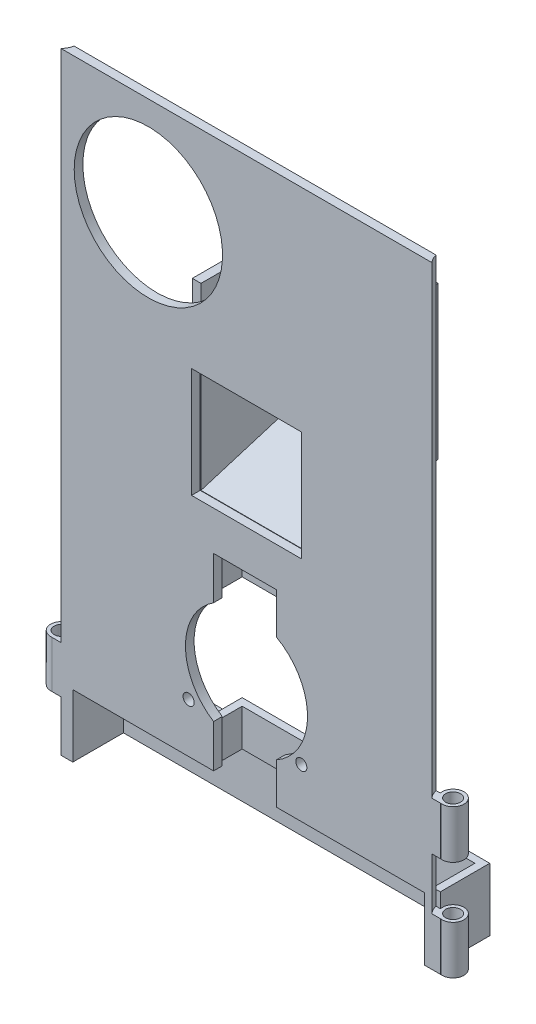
SolidWorks part; units mm, degrees
ref_plane "Front Plane" through (0, 0, 0) normal (0, 0, 1) x (1, 0, 0)
ref_plane "Top Plane" through (0, 0, 0) normal (0, 1, 0) x (1, 0, 0)
ref_plane "Right Plane" through (0, 0, 0) normal (1, 0, 0) x (0, 0, -1)
sketch "Sketch1" plane through (0, 0, 0) normal (0, 0, 1) x (1, 0, 0)
  line L1 (0, 0) -> (62.865, 0)
  line L2 (0, 0) -> (0, 99.06)
  line L3 (0, 99.06) -> (62.865, 99.06)
  line L4 (62.865, 0) -> (62.865, 99.06)
  dimension "D1" = 99.06
  dimension "D2" = 62.865
extrude "Boss-Extrude1" add sketch "Sketch1" along normal blind 1.4
sketch "Sketch2" plane through (0, 0, 0) normal (0, 1, 0) x (1, 0, 0)
  line L0 (31.4325, -1.4) -> (31.4325, 2.6427) construction
  line L1 (62.865, -1.4) -> (0, -1.4) construction
  line L2 (0, -1.4) -> (0, 0) construction
  circle A0 centre (-0.25, 0.35) radius 1.75
  circle A1 centre (63.115, 0.35) radius 1.75
  point P8 (0, -0.7)
  dimension "D1" = 0.25
extrude "Boss-Extrude2" add sketch "Sketch2" along normal up to surface (99.06 mm away)
ref_plane "Plane1" through (0, 12, 0) normal (0, 1, 0) x (1, 0, 0)
sketch "Sketch7" plane through (0, 12, 0) normal (0, 1, 0) x (1, 0, 0)
  line L0 (31.4325, -1.4) -> (31.4325, 1.55) construction
  line L1 (62.865, -1.4) -> (0, -1.4) construction
  circle A1 centre (-0.25, 0.35) radius 1.2
  circle A2 centre (63.115, 0.35) radius 1.2
extrude "Tube Hole" cut sketch "Sketch7" against normal through all both and the other way through all
sketch "Sketch8" plane through (0, 0, 0) normal (0, 0, -1) x (-1, 0, 0)
  line L0 (-31.4325, 99.06) -> (-31.4325, 40.64) construction
  line L1 (-61.4004, 99.06) -> (-1.4646, 99.06) construction
  line L2 (-1.4646, 0) -> (-61.4004, 0) construction
  line L3 (-36.2672, 16.7864) -> (-36.2672, 10.16)
  line L4 (-40.3225, 64.77) -> (-22.5425, 64.77)
  line L5 (-40.3225, 64.77) -> (-40.3225, 46.99)
  line L6 (-40.3225, 46.99) -> (-22.5425, 46.99)
  line L7 (-22.5425, 64.77) -> (-22.5425, 46.99)
  line L8 (-40.3225, 64.77) -> (-22.5425, 46.99) construction
  line L9 (-40.3225, 46.99) -> (-22.5425, 64.77) construction
  line L10 (-36.2672, 40.64) -> (-26.1072, 40.64)
  line L11 (-36.2672, 40.64) -> (-36.2672, 34.0136)
  line L12 (-36.2672, 10.16) -> (-26.1072, 10.16)
  line L13 (-26.1072, 40.64) -> (-26.1072, 33.7192)
  line L14 (-26.1072, 17.0808) -> (-26.1072, 10.16)
  line L17 (-31.4325, 10.16) -> (-31.4325, 0) construction
  circle A0 centre (-15.5525, 83.18) radius 12
  arc A1 (-36.2672, 34.0136) -> (-36.2672, 16.7864) centre (-31.4325, 25.4) ccw
  arc A3 (-26.1072, 17.0808) -> (-26.1072, 33.7192) centre (-31.4325, 25.4) ccw
  point P8 (-31.4325, 55.88)
  point P15 (-31.4325, 25.4)
  point P22 (-15.6947, 83.18)
  dimension "D6" = 25.4
  dimension "D7" = 10.16
  dimension "D1" = 15.88
  dimension "D2" = 15.88
  dimension "D3" = 17.78
  dimension "D4" = 17.78
  dimension "D5" = 46.99
  dimension "D8" = 30.48
  dimension "D9" = 10.16
extrude "Panel Holes" cut sketch "Sketch8" against normal blind 4.2
sketch "Sketch9" plane through (0, 12, 0) normal (0, 1, 0) x (1, 0, 0)
  circle A0 centre (63.115, 0.35) radius 2.4
extrude "Cut-Extrude1" cut sketch "Sketch9" against normal blind 4.2 and the other way blind 4.2
sketch "Sketch10" plane through (0, 12, 0) normal (0, 1, 0) x (1, 0, 0)
  circle A0 centre (63.115, 0.35) radius 2.4
extrude "Cut-Extrude2" cut sketch "Sketch10" along normal up to surface (75.06 mm away) from offset 12
sketch "Sketch11" plane through (0, 12, 0) normal (0, 1, 0) x (1, 0, 0)
  circle A0 centre (-0.25, 0.35) radius 2.4
extrude "Cut-Extrude3" cut sketch "Sketch11" against normal up to surface (8.2 mm away) from offset 3.8
sketch "Sketch12" plane through (0, 12, 0) normal (0, 1, 0) x (1, 0, 0)
  circle A0 centre (-0.25, 0.35) radius 2.4
extrude "Cut-Extrude4" cut sketch "Sketch12" along normal up to surface (83.26 mm away) from offset 3.8
sketch "Sketch13" plane through (0, 0, 0) normal (0, 0, -1) x (-1, 0, 0)
  line L0 (-31.4325, 99.06) -> (-31.7623, 0) construction
  line L1 (-60.7407, 99.06) -> (-2.1243, 99.06) construction
  line L2 (-2.1243, 0) -> (-61.4004, 0) construction
  line L3 (-40.3225, 46.99) -> (-22.5425, 46.99) construction
  line L4 (-41.8498, 76.07) -> (-21.2698, 76.07)
  line L5 (-41.8498, 76.07) -> (-41.8498, 45.59)
  line L6 (-41.8498, 45.59) -> (-21.2698, 45.59)
  line L7 (-21.2698, 76.07) -> (-21.2698, 45.59)
  line L8 (-41.8498, 76.07) -> (-21.2698, 45.59) construction
  line L9 (-41.8498, 45.59) -> (-21.2698, 76.07) construction
  point P6 (-31.5598, 60.83)
  dimension "D1" = 1.4
  dimension "D2" = 20.58
  dimension "D3" = 30.48
extrude "Boss-Extrude3" add sketch "Sketch13" along normal blind 19.18
sketch "Sketch14" plane through (0, 76.07, 0) normal (0, 1, 0) x (1, 0, 0)
  line L0 (60.7407, 0) -> (2.1243, 0) construction
  line L1 (22.6698, 0) -> (40.4498, 0)
  line L2 (22.6698, 0) -> (22.6698, 17.78)
  line L3 (22.6698, 17.78) -> (40.4498, 17.78)
  line L4 (40.4498, 0) -> (40.4498, 17.78)
  line L5 (21.2698, 19.18) -> (21.2698, 0) construction
  line L6 (41.8498, 19.18) -> (41.8498, 0) construction
  line L7 (21.2698, 19.18) -> (41.8498, 19.18) construction
  dimension "D1" = 1.4
  dimension "D2" = 1.4
  dimension "D3" = 1.4
sketch "Sketch15" plane through (21.2698, 0, 0) normal (-1, 0, 0) x (0, 0, 1)
  line L0 (-19.18, 45.59) -> (-19.18, 76.07) construction
  line L1 (-19.18, 51.432) -> (0, 45.59)
  line L2 (0, 45.59) -> (-19.18, 45.59)
  line L3 (-19.18, 45.59) -> (-19.18, 51.432)
  point P0 (-19.18, 51.432)
  dimension "D1" = 5.842
extrude "Cut-Extrude5" cut sketch "Sketch15" against normal through all
extrude "Cut-Extrude6" cut sketch "Sketch14" against normal offset from surface (29.0165 mm away) 1.4
sketch "Sketch16" plane through (0, 0, 0) normal (0, 0, -1) x (-1, 0, 0)
  line L0 (-41.3102, 25.4) -> (-21.5548, 25.4) construction
  line L1 (-31.1872, 40.64) -> (-31.1872, 10.16) construction
  line L2 (-26.1072, 40.64) -> (-36.2672, 40.64) construction
  line L3 (-36.2672, 10.16) -> (-26.1072, 10.16) construction
  line L4 (-38.0435, 16.3394) -> (-24.331, 10.3394) construction
  line L5 (-38.0435, 40.4606) -> (-24.331, 40.4606)
  line L6 (-38.0435, 40.4606) -> (-38.0435, 34.4606)
  line L7 (-38.0435, 34.4606) -> (-24.331, 34.4606)
  line L8 (-24.331, 40.4606) -> (-24.331, 34.4606)
  line L9 (-38.0435, 40.4606) -> (-24.331, 34.4606) construction
  line L10 (-38.0435, 34.4606) -> (-24.331, 40.4606) construction
  line L11 (-38.0435, 10.3394) -> (-24.331, 16.3394) construction
  line L12 (-24.331, 10.3394) -> (-24.331, 16.3394)
  line L13 (-38.0435, 16.3394) -> (-24.331, 16.3394)
  line L14 (-38.0435, 10.3394) -> (-38.0435, 16.3394)
  line L15 (-38.0435, 10.3394) -> (-24.331, 10.3394)
  arc A0 (-36.2672, 34.0136) -> (-36.2672, 16.7864) centre (-31.4325, 25.4) ccw construction
  arc A1 (-26.1072, 17.0808) -> (-26.1072, 33.7192) centre (-31.4325, 25.4) ccw construction
  point P14 (-31.1872, 37.4606)
  point P23 (-31.1872, 13.3394)
  dimension "D1" = 6
extrude "Boss-Extrude4" add sketch "Sketch16" along normal blind 5
sketch "Sketch17" plane through (0, 40.4606, 0) normal (0, 1, 0) x (1, 0, 0)
  line L0 (40.3225, 0) -> (22.6698, 0) construction
  line L1 (25.531, 0) -> (36.8435, 0)
  line L2 (25.531, 0) -> (25.531, 3.8)
  line L3 (25.531, 3.8) -> (36.8435, 3.8)
  line L4 (36.8435, 0) -> (36.8435, 3.8)
  line L5 (38.0435, 5) -> (38.0435, 0) construction
  line L6 (24.331, 5) -> (24.331, 0) construction
  line L7 (24.331, 5) -> (38.0435, 5) construction
  dimension "D1" = 1.2
  dimension "D2" = 1.2
  dimension "D3" = 1.2
extrude "Cut-Extrude7" cut sketch "Sketch17" against normal through all
sketch "Sketch18" plane through (0, 0, 0) normal (0, 0, -1) x (-1, 0, 0)
  line L0 (-31.7623, 0) -> (-31.7623, 25.1767) construction
  line L1 (-2.1243, 0) -> (-61.4004, 0) construction
  line L3 (-61.4004, 10.16) -> (-2.1243, 10.16)
  line L4 (-61.4004, 10.16) -> (-61.4004, 0)
  line L5 (-61.4004, 0) -> (-2.1243, 0)
  line L6 (-2.1243, 10.16) -> (-2.1243, 0)
  line L7 (-61.4004, 10.16) -> (-2.1243, 0) construction
  line L8 (-61.4004, 0) -> (-2.1243, 10.16) construction
  point P4 (-31.7623, 5.08)
  dimension "D1" = 10.16
extrude "Boss-Extrude5" add sketch "Sketch18" along normal blind 8
sketch "Sketch19" plane through (0, 0, 0) normal (0, -1, 0) x (1, 0, 0)
  line L0 (31.7623, -8) -> (31.7623, 1.4) construction
  line L1 (61.4004, -8) -> (2.1243, -8) construction
  line L2 (1.3924, 1.4) -> (62.865, 1.4) construction
  line L3 (2.1243, -8) -> (2.1243, 0) construction
  line L4 (3.3243, 3.1736) -> (60.2004, 3.1736)
  line L5 (3.3243, 3.1736) -> (3.3243, -6.8)
  line L6 (3.3243, -6.8) -> (60.2004, -6.8)
  line L7 (60.2004, 3.1736) -> (60.2004, -6.8)
  line L8 (3.3243, 3.1736) -> (60.2004, -6.8) construction
  line L9 (3.3243, -6.8) -> (60.2004, 3.1736) construction
  line L10 (61.4004, -8) -> (61.4004, -0.7) construction
  point P6 (31.7623, -1.8132)
  point P13 (2.1243, -4)
  dimension "D1" = 1.2
  dimension "D2" = 1.2
  dimension "D3" = 1.2
extrude "Cut-Extrude8" cut sketch "Sketch19" against normal up to surface (10.16 mm away)
sketch "Sketch20" plane through (0, 0, 1.4) normal (0, 0, 1) x (1, 0, 0)
  line L0 (11.8679, 18.16) -> (49.8625, 18.16) construction
  line L1 (60.2004, 10.16) -> (36.2672, 10.16) construction
  line L2 (31.1872, 40.4606) -> (31.1872, 10.3394) construction
  line L3 (36.8435, 40.4606) -> (25.531, 40.4606) construction
  line L4 (36.8435, 10.3394) -> (25.531, 10.3394) construction
  circle A0 centre (40.3061, 18.16) radius 0.9
  circle A1 centre (22.0684, 18.16) radius 0.9
  dimension "D1" = 8
extrude "Cut-Extrude9" cut sketch "Sketch20" against normal blind 8
